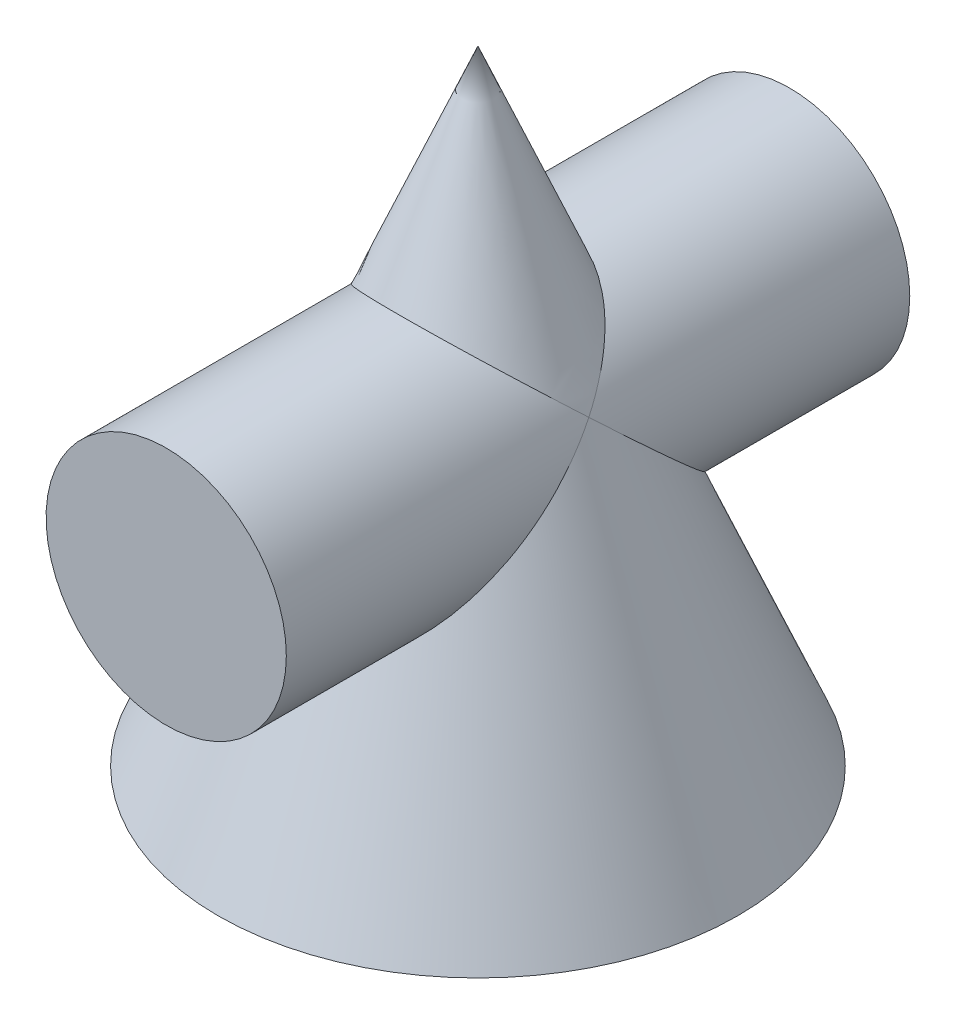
SolidWorks part; units mm, degrees
ref_plane "前视基准面" through (0, 0, 0) normal (0, 0, 1) x (1, 0, 0)
ref_plane "上视基准面" through (0, 0, 0) normal (0, 1, 0) x (1, 0, 0)
ref_plane "右视基准面" through (0, 0, 0) normal (1, 0, 0) x (0, 0, -1)
sketch "草图1" plane through (0, 0, 0) normal (0, 0, 1) x (1, 0, 0)
  line L0 (0, 86.6588) -> (0, -85.5382) construction
  line L1 (0, 60.5118) -> (-25, 0.5118)
  line L2 (-25, 0.5118) -> (0, 0.5118)
  line L3 (0, 60.5118) -> (0, 0.5118)
  dimension "D1" = 60
  dimension "D2" = 25
revolve "旋转1" add sketch "草图1" angle 360 about L0
sketch "草图2" plane through (0, 0, 0) normal (0, 0, 1) x (1, 0, 0)
  line L0 (0, 62.9224) -> (0, -2.0142) construction
  line L1 (-19.0888, 30.4541) -> (21.1649, 30.4541) construction
  line L2 (0, 60.5118) -> (-25, 0.5118) construction
  line L4 (25, 0.5118) -> (0, 60.5118) construction
  circle A0 centre (0, 30.4541) radius 11.5606
extrude "拉伸1" add sketch "草图2" along normal mid plane 60
